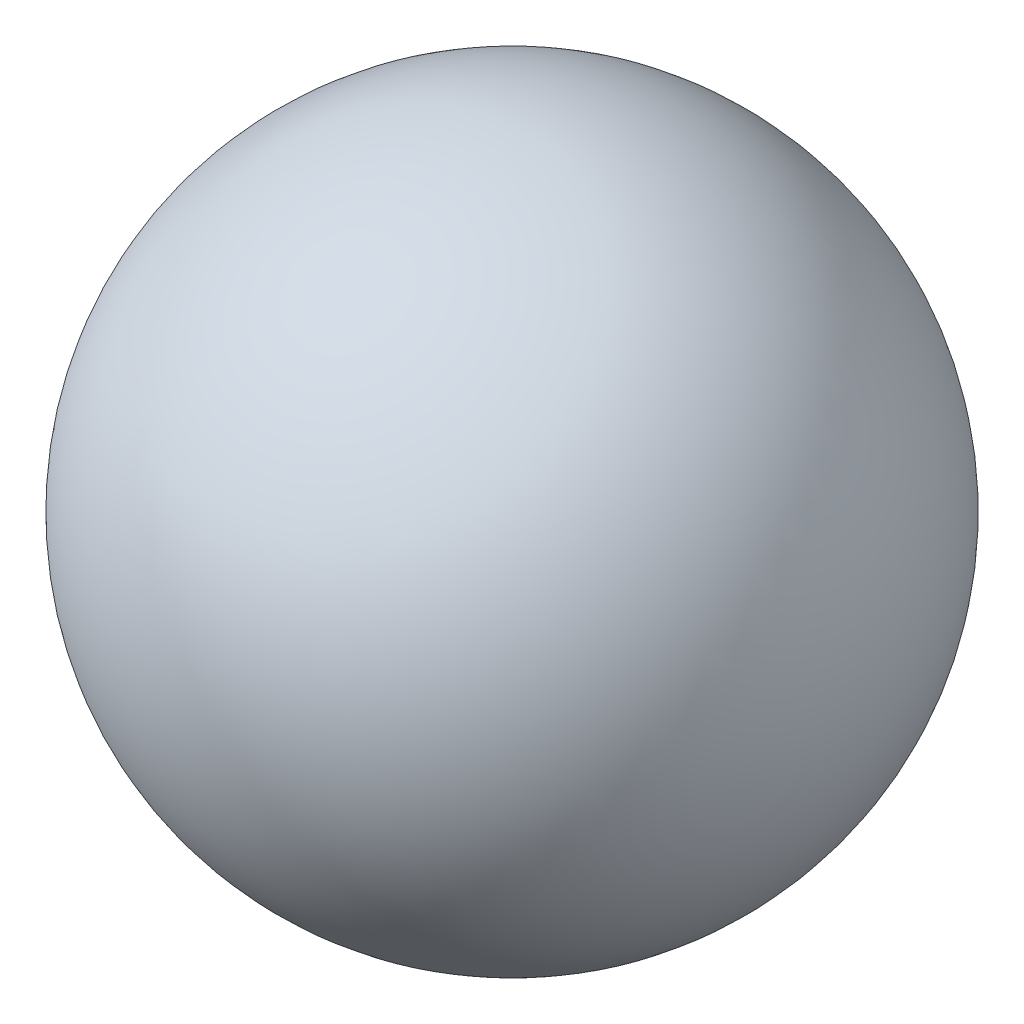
SolidWorks part; units mm, degrees
ref_plane "Plan de face" through (0, 0, 0) normal (0, 0, 1) x (1, 0, 0)
ref_plane "Plan de dessus" through (0, 0, 0) normal (0, 1, 0) x (1, 0, 0)
ref_plane "Plan de droite" through (0, 0, 0) normal (1, 0, 0) x (0, 0, -1)
sketch "Esquisse1" plane through (0, 0, 0) normal (0, 0, 1) x (1, 0, 0)
  line L0 (6.5, 21) -> (6.5, 7.5) construction
  line L1 (1, 21) -> (12, 21) construction
  line L2 (0, 20) -> (0, 8.5) construction
  line L3 (1, 7.5) -> (12, 7.5) construction
  line L4 (13, 20) -> (13, 8.5) construction
  line L5 (13, 16.95) -> (0, 16.95) construction
  line L6 (13, 11.55) -> (0, 11.55) construction
  line L7 (0, 0) -> (13, 0) construction
  line L8 (6.5, 18.3) -> (6.5, 10.2)
  arc A1 (0, 8.5) -> (1, 7.5) centre (1, 8.5) ccw construction
  arc A2 (1, 21) -> (0, 20) centre (1, 20) ccw construction
  arc A3 (13, 20) -> (12, 21) centre (12, 20) ccw construction
  arc A4 (12, 7.5) -> (13, 8.5) centre (12, 8.5) ccw construction
  arc A5 (6.5, 18.3) -> (6.5, 10.2) centre (6.5, 14.25) ccw
  dimension "D4" = 1
  dimension "D5" = 8.1
  dimension "D1" = 7.5
  dimension "D2" = 21
  dimension "D3" = 13
  dimension "D6" = 11.55
  dimension "D7" = 16.95
revolve "Révolution1" add sketch "Esquisse1" angle 360 about L0
